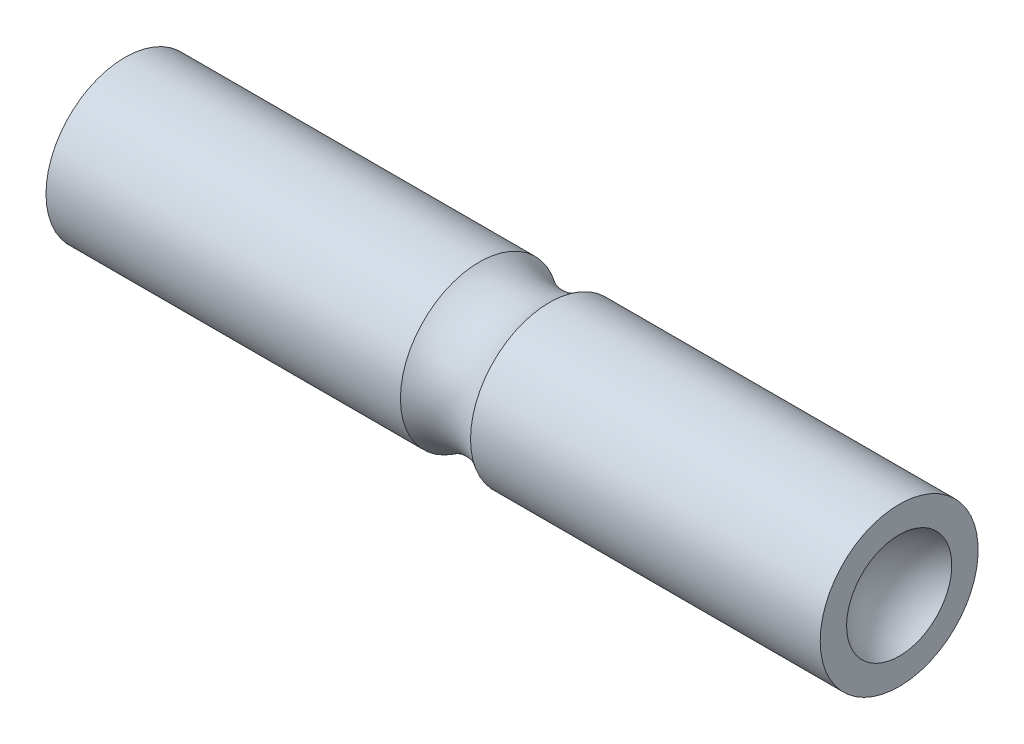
SolidWorks part; units mm, degrees
ref_plane "Front Plane" through (0, 0, 0) normal (0, 0, 1) x (1, 0, 0)
ref_plane "Top Plane" through (0, 0, 0) normal (0, 1, 0) x (1, 0, 0)
ref_plane "Right Plane" through (0, 0, 0) normal (1, 0, 0) x (0, 0, -1)
sketch "Sketch1" plane through (0, 0, 0) normal (0, 0, 1) x (1, 0, 0)
  line L0 (0, 0) -> (19.939, 0)
  line L1 (19.939, 0) -> (19.939, 1.9812)
  line L2 (19.939, 1.9812) -> (11.1665, 1.9812)
  line L3 (9.4075, 1.9812) -> (0, 1.9812)
  line L4 (0.7338, 0) -> (2.7538, 0) construction
  line L5 (0, 1.9812) -> (0, 0)
  arc A0 (11.1665, 1.9812) -> (9.4075, 1.9812) centre (10.287, 3.2258) cw
  arc A1 (19.177, 0) -> (19.939, 1.3198) centre (20.701, 0) cw
  arc A2 (0, 0) -> (0.5156, 1.9812) centre (4.064, 0) cw
  point P9 (10.287, 1.7018)
  dimension "D1" = 1.524
  dimension "D5" = 1.7018
  dimension "D6" = 1.524
  dimension "D8" = 4.064
  dimension "D2" = 3.9624
  dimension "D3" = 19.939
  dimension "D4" = 9.652
  dimension "D7" = 0.762
revolve "Revolve1" add sketch "Sketch1" angle 360 about L4
